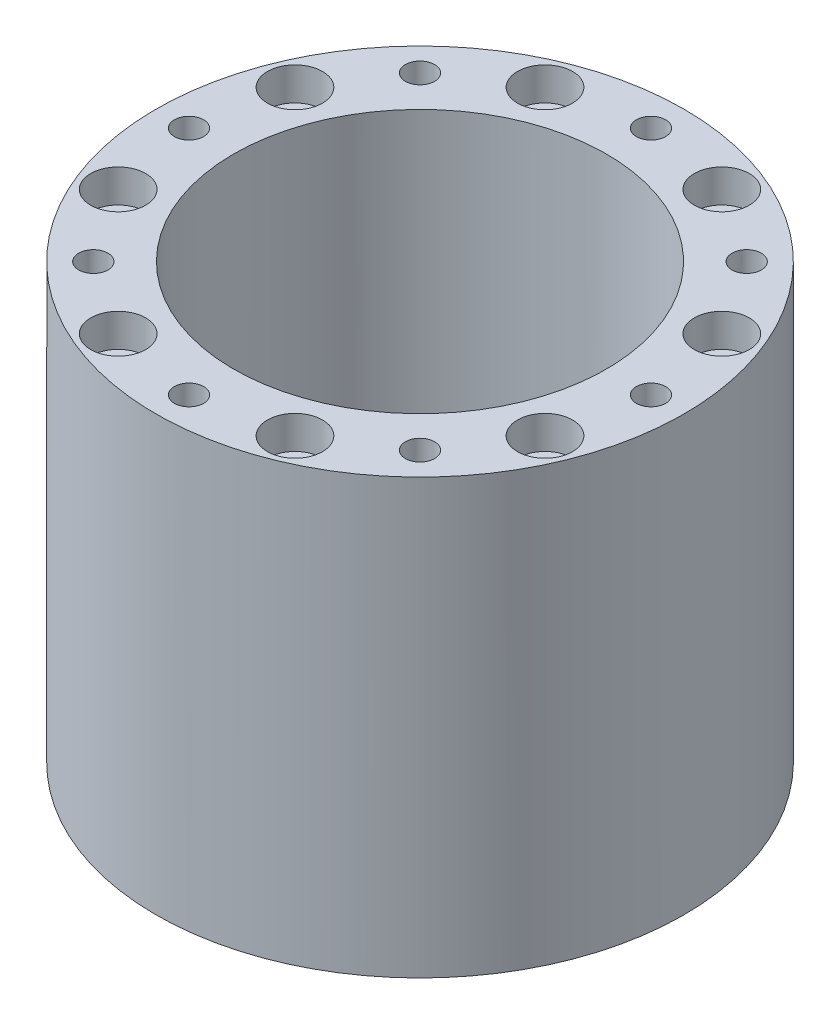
SolidWorks part; units mm, degrees
ref_plane "Front Plane" through (0, 0, 0) normal (0, 0, 1) x (1, 0, 0)
ref_plane "Top Plane" through (0, 0, 0) normal (0, 1, 0) x (1, 0, 0)
ref_plane "Right Plane" through (0, 0, 0) normal (1, 0, 0) x (0, 0, -1)
body saved out of another part "Stock-SolidRocketV6-1"
move or copy body "Body-Move/Copy1" bodies to move or copy 101 placed by mates yes
hole_wizard "3/8-24 Tapped Hole1" positions "Sketch1" profile "Sketch2" tap size "3/8-24" standard "ANSI Inch"
sketch "Sketch1" plane through (0, 0, 0) normal (0, 1, 0) x (1, 0, 0)
  line L0 (0, 0) -> (66.675, 0) construction
  circle A0 centre (0, 0) radius 66.675 construction
  point P7 (66.675, 0)
  dimension "D1" = 133.35
sketch "Sketch2" plane through (66.675, 0, 0) normal (1, 0, 0) x (0, 0, 1)
  line L0 (0, 0) -> (0, 24.761)
  line L1 (0, 24.761) -> (4.2164, 22.2275)
  line L2 (4.2164, 22.2275) -> (4.2164, 0)
  line L5 (4.2164, 0) -> (0, 0)
  line L10 (0, 24.761) -> (-4.2164, 22.2275) construction
  line L11 (0, -6.35) -> (0, 107.95) construction
  dimension "Tap Drill Dia." = 8.4328
  dimension "Tap Drill Depth" = 22.2275
  dimension "Drill Angle" = 118
pattern_circular "CirPattern1" count 8 over 360 about axis through (0, 0, 0) along (0, 1, 0) of "3/8-24 Tapped Hole1"
hole_wizard "CBORE for 3/8 Socket Head Cap Screw1" positions "Sketch4" profile "Sketch5" counterbore size "3/8" standard "ANSI Inch"
sketch "Sketch4" plane through (0, 0, 0) normal (0, 1, 0) x (1, 0, 0)
  line L0 (66.675, 0) -> (0, 0) construction
  line L1 (0, 0) -> (61.5997, -25.5154) construction
  circle A0 centre (0, 0) radius 66.675 construction
  point P7 (61.5997, -25.5154)
  dimension "D1" = 133.35
  dimension "D2" = 22.5
sketch "Sketch5" plane through (61.5997, 0, 25.5154) normal (1, 0, 0) x (0, 0, 1)
  line L0 (0, 0) -> (0, 125.205)
  line L1 (0, 125.205) -> (4.9022, 125.205)
  line L3 (4.9022, 125.205) -> (4.9022, 9.525)
  line L4 (4.9022, 9.525) -> (7.9375, 9.525)
  line L5 (7.9375, 9.525) -> (7.9375, 0)
  line L7 (7.9375, 0) -> (0, 0)
  line L11 (0, -6.35) -> (0, 107.95) construction
  dimension "Thru Hole Dia." = 9.8044
  dimension "Thru Hole Depth" = 125.205
  dimension "C'Bore Dia." = 15.875
  dimension "C'Bore Depth" = 9.525
pattern_circular "CirPattern2" count 8 over 360 about axis through (0, 0, 0) along (0, 1, 0) of "CBORE for 3/8 Socket Head Cap Screw1"
